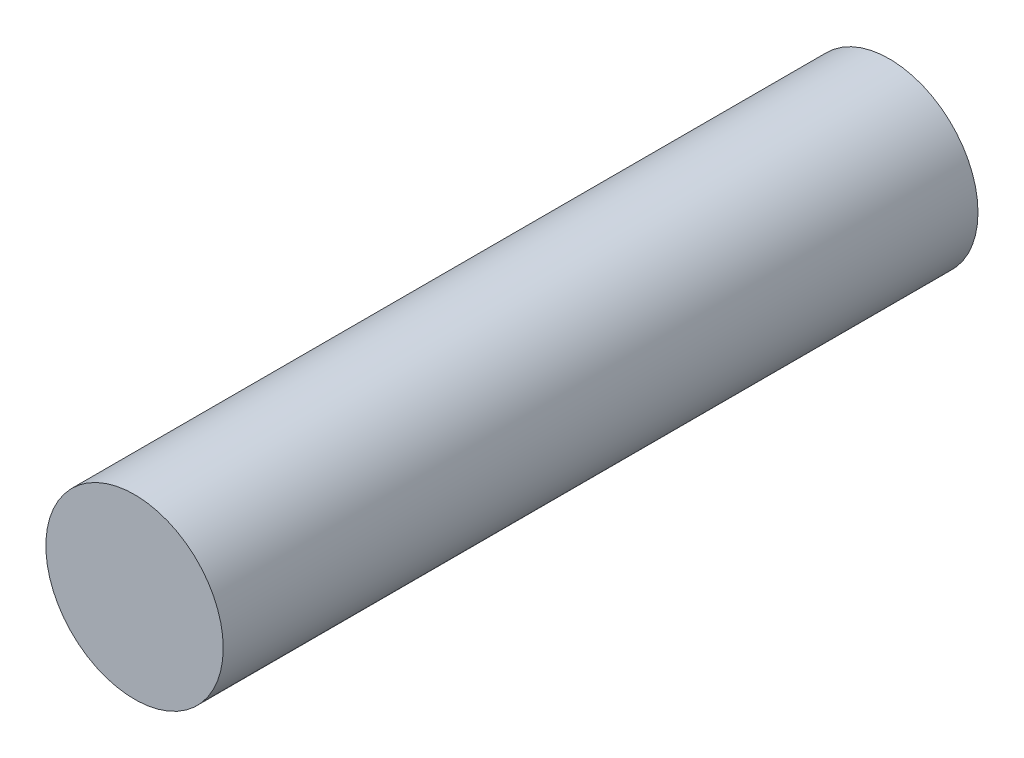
SolidWorks part; units mm, degrees
ref_plane "Front Plane" through (0, 0, 0) normal (0, 0, 1) x (1, 0, 0)
ref_plane "Top Plane" through (0, 0, 0) normal (0, 1, 0) x (1, 0, 0)
ref_plane "Right Plane" through (0, 0, 0) normal (1, 0, 0) x (0, 0, -1)
sketch "Sketch1" plane through (0, 0, 0) normal (0, 0, 1) x (1, 0, 0)
  circle A0 centre (0, 0) radius 1.1938
  dimension "D1" = 2.3876
extrude "Extrude1" add sketch "Sketch1" along normal mid plane 10.16
